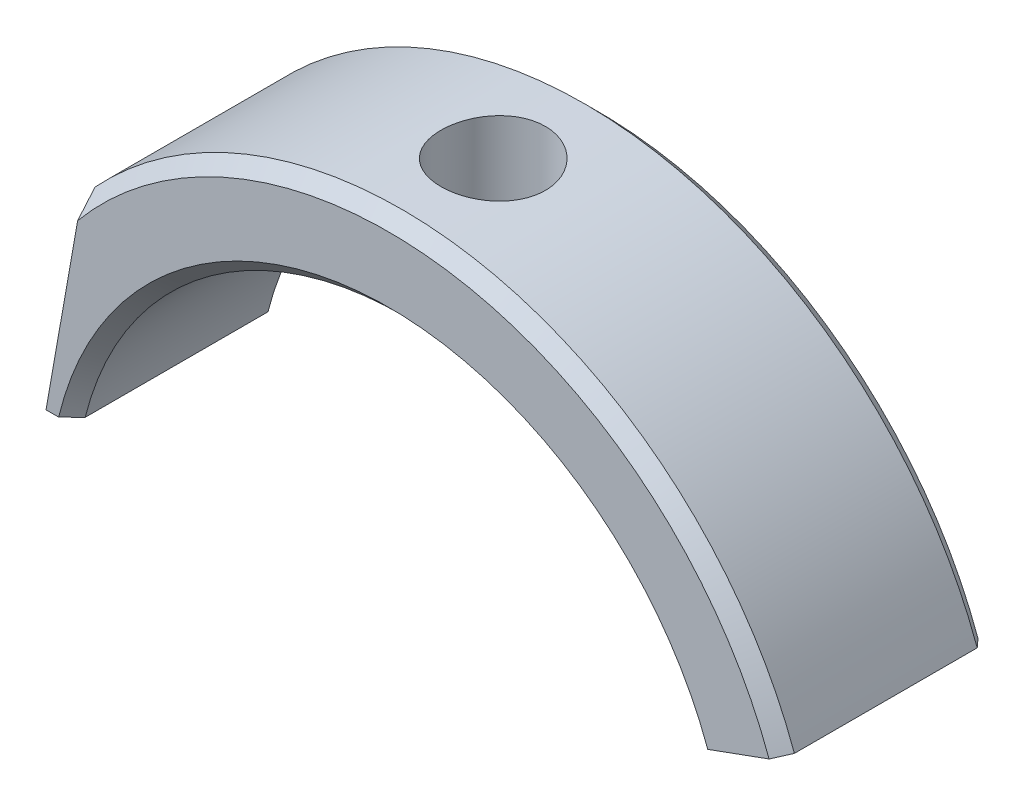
SolidWorks part; units mm, degrees
ref_plane "Face" through (0, 0, 0) normal (0, 0, 1) x (1, 0, 0)
ref_plane "Dessus" through (0, 0, 0) normal (0, 1, 0) x (1, 0, 0)
ref_plane "Droite" through (0, 0, 0) normal (1, 0, 0) x (0, 0, -1)
sketch "Esquisse1" plane through (0, 0, 0) normal (0, 0, 1) x (1, 0, 0)
  line L0 (-11.7452, 10.8651) -> (-13.1257, 3.0362)
  line L1 (-12.1257, 3.0362) -> (-13.1257, 3.0362)
  line L2 (11.7462, 4.2753) -> (15.0351, 5.4723)
  line L3 (-5.7785, 0) -> (5.9569, 0) construction
  line L4 (0, 0) -> (-11.7452, 10.8651) construction
  line L5 (0, 0) -> (15.0351, 5.4723) construction
  arc A0 (11.7462, 4.2753) -> (-12.1257, 3.0362) centre (0, 0) ccw
  arc A1 (15.0351, 5.4723) -> (-11.7452, 10.8651) centre (0, 0) ccw
  dimension "D1" = 25
  dimension "D3" = 1
  dimension "D4" = 20
  dimension "D5" = 80
  dimension "D6" = 7.9497
  dimension "D2" = 3.5
extrude "Base-Extrusion" add sketch "Esquisse1" along normal mid plane 8
sketch "Esquisse2" plane through (0, 0, 0) normal (0, 1, 0) x (1, 0, 0)
  circle A0 centre (0, 0) radius 2
  dimension "D1" = 4
extrude "Enlèv. mat.-Extru.2" cut sketch "Esquisse2" along normal through all
chamfer "Chanfrein2" distance 0.5 angle 45
